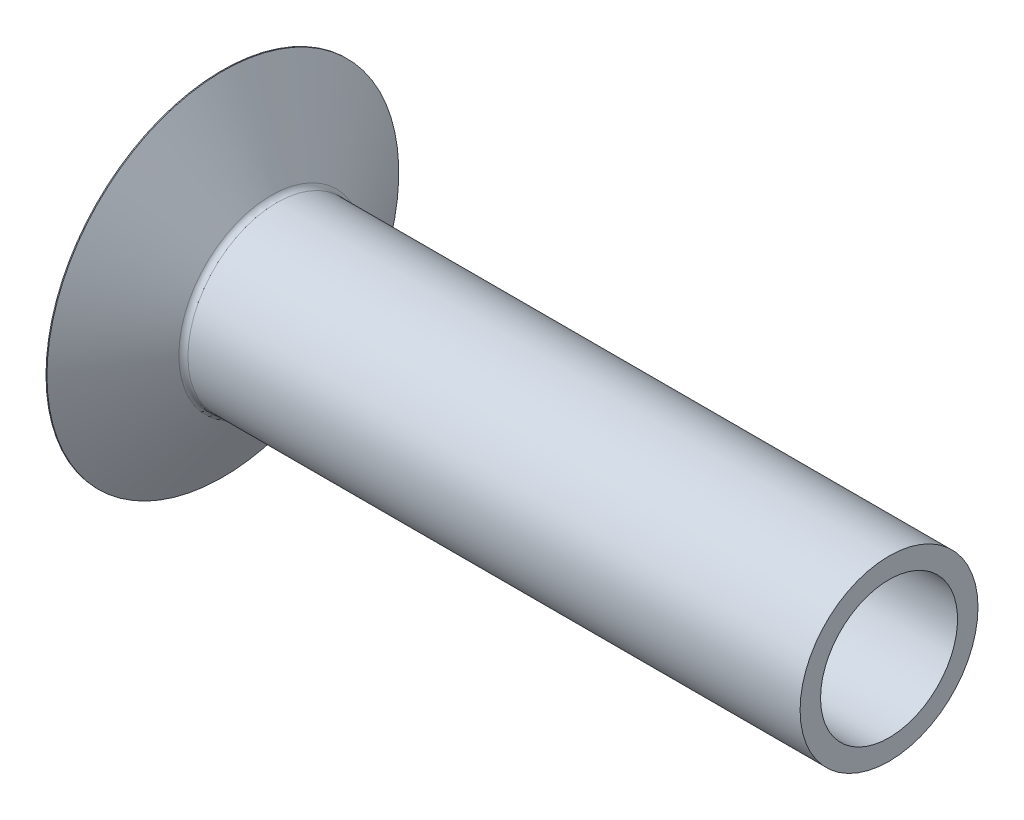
SolidWorks part; units mm, degrees
ref_plane "Front" through (0, 0, 0) normal (0, 0, 1) x (1, 0, 0)
ref_plane "Top" through (0, 0, 0) normal (0, 1, 0) x (1, 0, 0)
ref_plane "Right" through (0, 0, 0) normal (1, 0, 0) x (0, 0, -1)
other "Configuration Table"
sketch "Sketch1" plane through (0, 0, 0) normal (0, 0, 1) x (1, 0, 0)
  line L0 (-55.4117, 0) -> (10.9263, 0) construction
  line L1 (30, 0) -> (30, 4)
  line L2 (30, 4) -> (2.4732, 4)
  line L3 (2.2134, 4.15) -> (0.0426, 7.91)
  line L4 (0.0426, 7.91) -> (0, 7.91)
  line L5 (0, 7.91) -> (0, 0)
  line L6 (30, 0) -> (0, 0)
  line L7 (2.4732, 4) -> (2.3, 4) construction
  line L8 (2.2134, 4.15) -> (2.3, 4) construction
  arc A0 (2.4732, 4) -> (2.2134, 4.15) centre (2.4732, 4.3) cw
  dimension "r" = 0.3
  dimension "d" = 8
  dimension "l" = 30
  dimension "D3" = 60
  dimension "dk" = 15.82
  dimension "k" = 2.3
revolve "Base-Revolve" add sketch "Sketch1" angle 360 about L0
sketch "Sketch3" plane through (0, 0, 0) normal (0, 0, 1) x (1, 0, 0)
  line L0 (-6.108, 0) -> (1.7598, 0) construction
  line L2 (30, 3.08) -> (21.65, 3.08)
  line L4 (21.65, 3.08) -> (19.8718, 0)
  line L5 (30, 0) -> (30, 3.08)
  line L6 (19.8718, 0) -> (30, 0)
  line L7 (30, -4) -> (30, 4) construction
  dimension "D1" = 60
  dimension "dt" = 6.16
  dimension "t" = 8.35
revolve "Cut-Revolve1" cut sketch "Sketch3" angle 360 about L0
